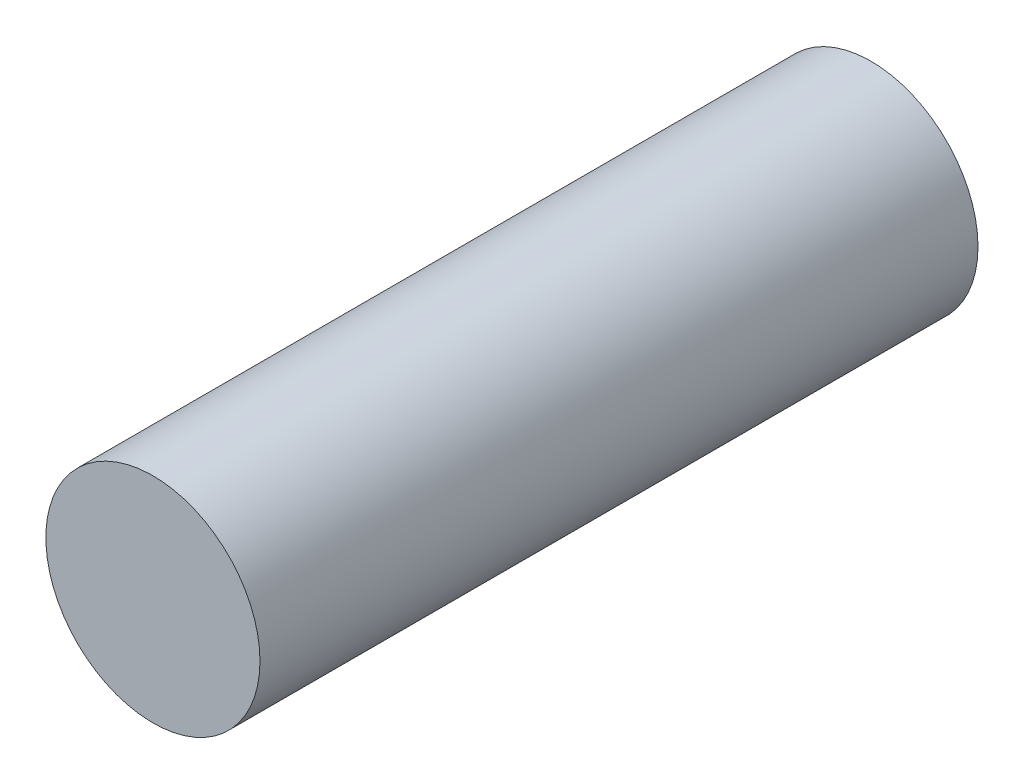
SolidWorks part; units mm, degrees
ref_plane "Front Plane" through (0, 0, 0) normal (0, 0, 1) x (1, 0, 0)
ref_plane "Top Plane" through (0, 0, 0) normal (0, 1, 0) x (1, 0, 0)
ref_plane "Right Plane" through (0, 0, 0) normal (1, 0, 0) x (0, 0, -1)
sketch "Sketch1" plane through (0, 0, 0) normal (0, 0, 1) x (1, 0, 0)
  circle A0 centre (0, 0) radius 0.6477
extrude "Boss-Extrude1" add sketch "Sketch1" along normal blind 4.3434
